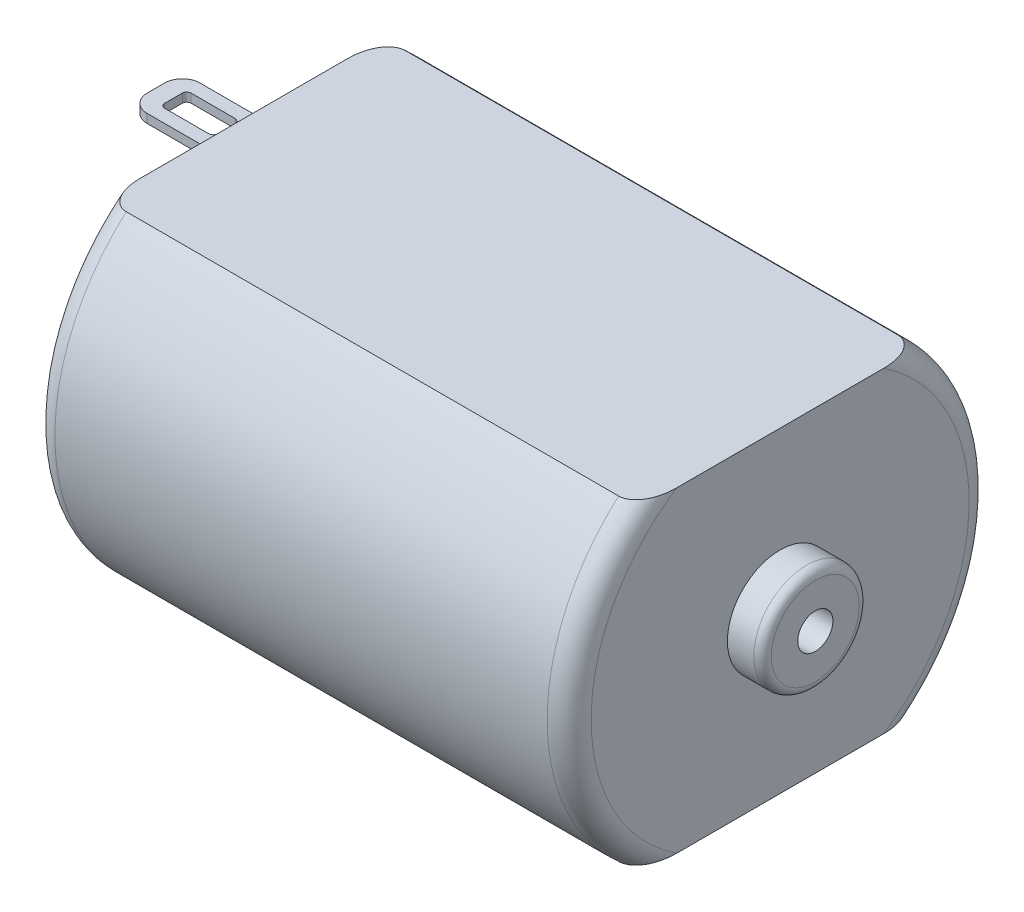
SolidWorks part; units mm, degrees
ref_plane "Face" through (0, 0, 0) normal (0, 0, 1) x (1, 0, 0)
ref_plane "Dessus" through (0, 0, 0) normal (0, 1, 0) x (1, 0, 0)
ref_plane "Droite" through (0, 0, 0) normal (1, 0, 0) x (0, 0, -1)
sketch "Esquisse1" plane through (0, 0, 0) normal (0, 0, 1) x (1, 0, 0)
  line L0 (-35.7245, 0) -> (21.4609, 0) construction
  line L1 (-30.5, 10.75) -> (-30.5, 4)
  line L2 (0, 10.75) -> (0, 3)
  line L3 (-29.25, 12) -> (-1.25, 12)
  line L4 (2, 2.5) -> (2, 0)
  line L5 (0, 3) -> (1.5, 3)
  line L6 (-32.5, 3.5) -> (-32.5, 0)
  line L7 (-32, 4) -> (-30.5, 4)
  line L10 (-32.5, 0) -> (2, 0)
  arc A0 (-32.5, 3.5) -> (-32, 4) centre (-32, 3.5) cw
  arc A1 (1.5, 3) -> (2, 2.5) centre (1.5, 2.5) cw
  arc A3 (0, 10.75) -> (-1.25, 12) centre (-1.25, 10.75) ccw
  arc A4 (-30.5, 10.75) -> (-29.25, 12) centre (-29.25, 10.75) cw
  dimension "D9" = 0.5
  dimension "D10" = 0.5
  dimension "D12" = 1.25
  dimension "D1" = 12
  dimension "D2" = 30.5
  dimension "D3" = 3
  dimension "D4" = 2
  dimension "D5" = 4
  dimension "D6" = 2
revolve "Révolution1" add sketch "Esquisse1" angle 360 about L0
sketch "Esquisse2" plane through (-30.5, 0, 0) normal (-1, 0, 0) x (0, 0, 1)
  line L0 (-1.5, 8) -> (1.5, 8)
  line L1 (1.5, 8) -> (1.5, 7.5)
  line L2 (-1.5, 8) -> (-1.5, 7.5)
  line L3 (-1.5, 7.5) -> (1.5, 7.5)
  line L4 (-6.4748, 0) -> (7.6259, 0) construction
  dimension "D1" = 8
  dimension "D2" = 1.5
  dimension "D3" = 1.5
  dimension "D4" = 0.5
extrude "Extrusion1" add sketch "Esquisse2" along normal blind 5
sketch "Esquisse3" plane through (0, 8, 0) normal (0, 1, 0) x (-1, 0, 0)
  line L0 (34.5, -1.5) -> (36, -1.5)
  line L1 (35.5, -0.5) -> (35.5, 0.5)
  line L2 (35.5, -1.5) -> (30.5, -1.5) construction
  line L3 (34.25, -0.75) -> (31.75, -0.75)
  line L4 (34.5, -0.5) -> (34.5, 0.5)
  line L5 (34.25, 0.75) -> (31.75, 0.75)
  line L6 (31.5, -0.5) -> (31.5, 0.5)
  line L7 (36, -1.5) -> (36, 1.5)
  line L8 (36, 1.5) -> (34.5, 1.5)
  line L9 (30.5, -10.75) -> (30.5, 10.75) construction
  line L10 (35.5, 1.5) -> (35.5, -1.5) construction
  line L12 (30.5, 0) -> (35.5, 0) construction
  line L13 (30.5, 1.5) -> (30.5, -1.5) construction
  arc A0 (35.5, -0.5) -> (34.5, -1.5) centre (34.5, -0.5) cw
  arc A1 (34.5, 1.5) -> (35.5, 0.5) centre (34.5, 0.5) cw
  arc A2 (34.5, -0.5) -> (34.25, -0.75) centre (34.25, -0.5) cw
  arc A3 (34.25, 0.75) -> (34.5, 0.5) centre (34.25, 0.5) cw
  arc A4 (31.5, 0.5) -> (31.75, 0.75) centre (31.75, 0.5) cw
  arc A5 (31.75, -0.75) -> (31.5, -0.5) centre (31.75, -0.5) cw
  point P10 (35.5, -1.5)
  point P13 (35.5, 1.5)
  dimension "D1" = 1
  dimension "D2" = 1
  dimension "D5" = 0.25
  dimension "D6" = 0.25
  dimension "D3" = 1.5
  dimension "D4" = 0.75
  dimension "D7" = 3
  dimension "D8" = 1
  dimension "D9" = 0.5
  dimension "D10" = 3
extrude "Enlèv. mat.-Extru.1" cut sketch "Esquisse3" against normal up to next
pattern_circular "Répétition circulaire3" count 2 every 180 about axis through (0, 0, 0) along (1, 0, 0) of "Extrusion1", "Enlèv. mat.-Extru.1"
sketch "Esquisse4" plane through (0, 0, 0) normal (1, 0, 0) x (0, 0, -1)
  line L0 (0, 0) -> (0, 11.5) construction
  line L2 (-12, 14) -> (12, 14)
  line L3 (-12, 14) -> (-12, 9)
  line L4 (-12, 9) -> (12, 9)
  line L5 (12, 14) -> (12, 9)
  line L6 (-12, 14) -> (12, 9) construction
  line L7 (-12, 9) -> (12, 14) construction
  dimension "D1" = 9
  dimension "D2" = 24
  dimension "D3" = 5
extrude "Enlèv. mat.-Extru.2" cut sketch "Esquisse4" against normal through all
mirror "Symétrie1" about plane through (0, 0, 0) normal (0, 1, 0) of "Enlèv. mat.-Extru.2"
sketch "Esquisse5" plane through (2, 0, 0) normal (1, 0, 0) x (0, 0, -1)
  circle A0 centre (0, 0) radius 1
  dimension "D1" = 2
extrude "Enlèv. mat.-Extru.3" cut sketch "Esquisse5" against normal blind 15
sketch "Esquisse6" plane through (0, 0, 0) normal (1, 0, 0) x (0, 0, -1)
  line L0 (0, 0) -> (3.2209, -1.2364) construction
  line L1 (0, 0) -> (0, 3.45) construction
  line L2 (0, 0) -> (-3.2209, -1.2364) construction
  arc A0 (3.2209, -1.2364) -> (-3.2209, -1.2364) centre (0, 0) ccw construction
  point P1 (0, 0)
  dimension "D1" = 6.9
  dimension "D2" = 111
  dimension "D3" = 111
